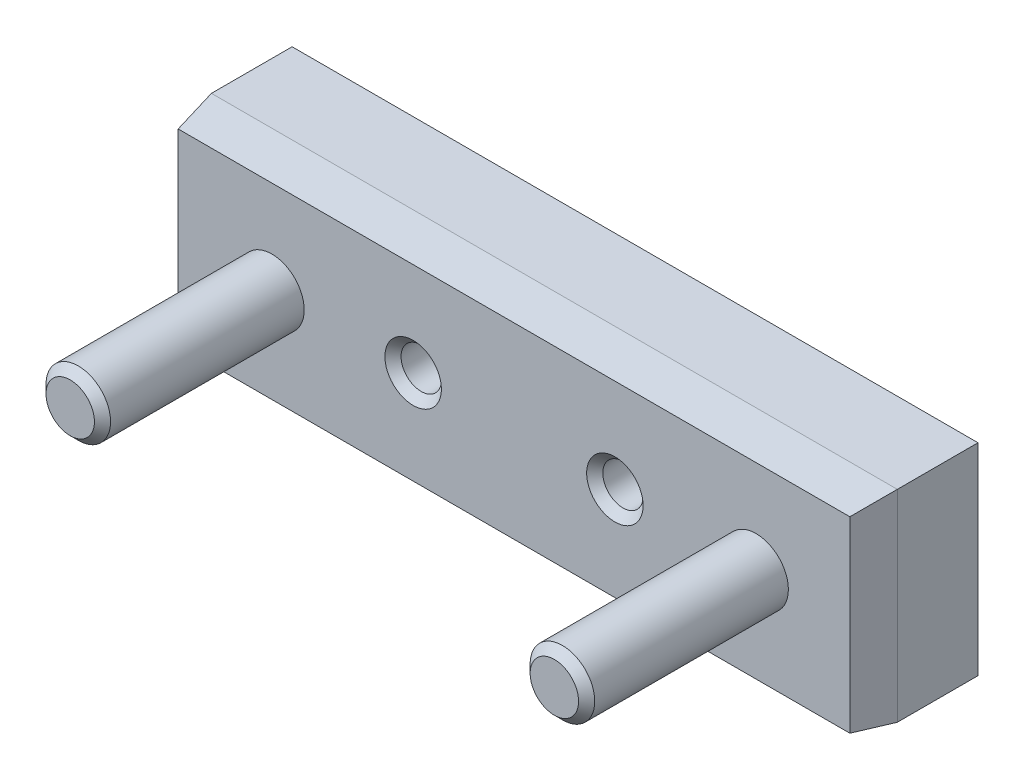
SolidWorks part; units mm, degrees
ref_plane "Plan1" through (0, 0, 0) normal (0, 0, 1) x (1, 0, 0)
ref_plane "Plan2" through (0, 0, 0) normal (0, 1, 0) x (1, 0, 0)
ref_plane "Plan3" through (0, 0, 0) normal (1, 0, 0) x (0, 0, -1)
sketch "Esquisse1" plane through (0, 0, 0) normal (0, 0, 1) x (1, 0, 0)
  line L0 (-42.5, 25) -> (42.5, 25)
  line L1 (-42.5, 25) -> (-42.5, 0)
  line L2 (42.5, 0) -> (-42.5, 0)
  line L3 (42.5, 0) -> (42.5, 25)
  dimension "D1" = 85
  dimension "D2" = 25
extrude "Base-Extrusion" add sketch "Esquisse1" along normal blind 15
sketch "Esquisse2" plane through (0, 0, 15) normal (0, 0, 1) x (1, 0, 0)
  line L0 (42.5, 0) -> (-42.5, 0) construction
  circle A0 centre (-30, 12.5) radius 4
  circle A1 centre (30, 12.5) radius 4
  dimension "D1" = 8
  dimension "D2" = 12.5
  dimension "D3" = 60
  dimension "D4" = 30
extrude "Boss.-Extru.1" add sketch "Esquisse2" along normal blind 25
sketch "Esquisse3" plane through (0, 0, 15) normal (0, 0, 1) x (1, 0, 0)
  circle A0 centre (-12.5, 12.5) radius 2.5
  circle A1 centre (12.5, 12.5) radius 2.5
  dimension "D1" = 5
  dimension "D2" = 25
  dimension "D3" = 12.5
extrude "Enlèv. mat.-Extru.1" cut sketch "Esquisse3" against normal through all
chamfer "Chanfrein1" distance 1 angle 45
chamfer "Chanfrein2" distance 5 angle 10
